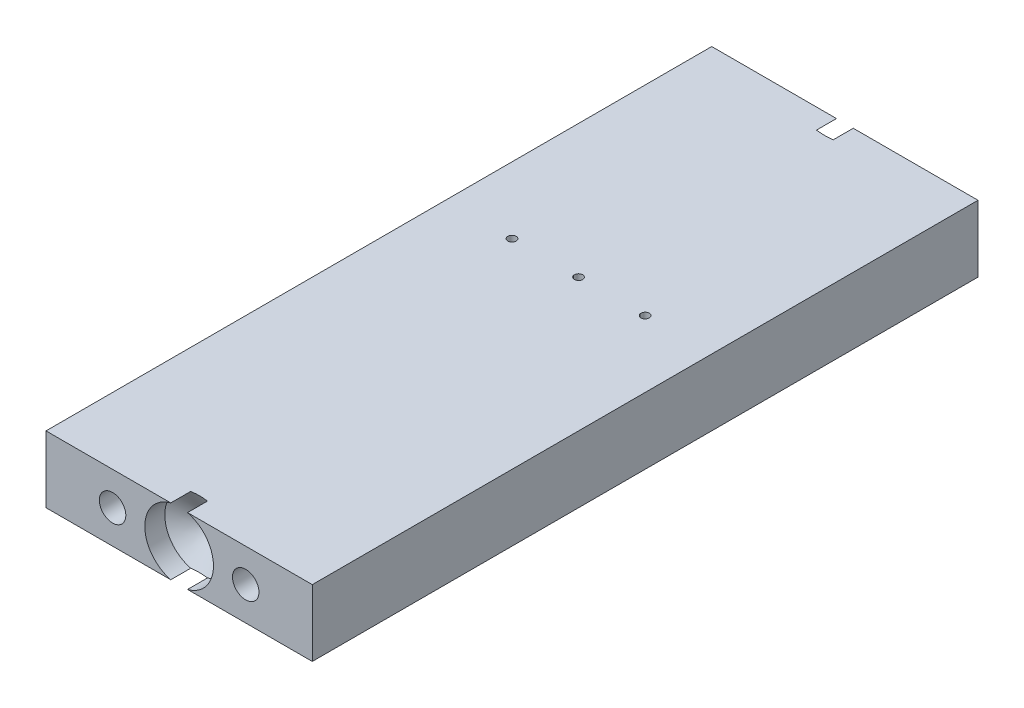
SolidWorks part; units mm, degrees
ref_plane "Front Plane" through (0, 0, 0) normal (0, 0, 1) x (1, 0, 0)
ref_plane "Top Plane" through (0, 0, 0) normal (0, 1, 0) x (1, 0, 0)
ref_plane "Right Plane" through (0, 0, 0) normal (1, 0, 0) x (0, 0, -1)
sketch "Sketch1" plane through (0, 0, 0) normal (0, 1, 0) x (1, 0, 0)
  line L1 (-25.4, -63.5) -> (25.4, -63.5)
  line L2 (-25.4, -63.5) -> (-25.4, 63.5)
  line L3 (-25.4, 63.5) -> (25.4, 63.5)
  line L4 (25.4, -63.5) -> (25.4, 63.5)
  line L5 (-25.4, -63.5) -> (25.4, 63.5) construction
  line L6 (-25.4, 63.5) -> (25.4, -63.5) construction
  point P0 (0, 0)
extrude "Boss-Extrude1" add sketch "Sketch1" along normal blind 12.7
hole_wizard "1/16 (0.0625) Diameter Hole1" positions "Sketch2" profile "Sketch4" hole size "1/16" standard "ANSI Inch"
sketch "Sketch2" plane through (0, 12.7, 0) normal (0, 1, 0) x (1, 0, 0)
  line L0 (-25.4, -63.5) -> (25.4, -63.5) construction
  point P0 (0, 12.7)
  point P2 (12.7, 12.7)
  point P4 (-12.7, 12.7)
  dimension "D1" = 12.7
  dimension "D2" = 76.2
  dimension "D3" = 76.2
  dimension "D4" = 12.7
  dimension "D5" = 12.7
  dimension "D6" = 0
sketch "Sketch4" plane through (0, 12.7, -12.7) normal (1, 0, 0) x (0, 0, 1)
  line L0 (0, 0) -> (0, 12.7)
  line L1 (0, 12.7) -> (0.7937, 12.7)
  line L2 (0.7937, 12.7) -> (0.7937, 0)
  line L5 (0.7937, 0) -> (0, 0)
  line L11 (0, -6.35) -> (0, 107.95) construction
  dimension "Thru Hole Dia." = 1.5875
  dimension "Thru Hole Depth" = 12.7
sketch "Sketch5" plane through (0, 12.7, 0) normal (0, 1, 0) x (1, 0, 0)
  line L0 (-25.4, -12.7) -> (25.4, -12.7)
  line L1 (-25.4, 63.5) -> (-25.4, -63.5) construction
  line L2 (25.4, -63.5) -> (25.4, 63.5) construction
  line L3 (25.4, -12.7) -> (-25.4, -12.7)
  line L4 (-25.4, -63.5) -> (25.4, -63.5) construction
  dimension "D1" = 50.8
hole_wizard "#8 (0.199) Diameter Hole1" positions "Sketch8" profile "Sketch10" hole size "#8" standard "ANSI Inch"
sketch "Sketch8" plane through (0, 0, 63.5) normal (0, 0, 1) x (1, 0, 0)
  line L0 (-25.4, 12.7) -> (-25.4, 0) construction
  line L1 (-25.4, 0) -> (25.4, 0) construction
  point P0 (-12.7, 6.35)
  point P2 (12.7, 6.35)
  dimension "D1" = 25.4
  dimension "D2" = 12.7
  dimension "D3" = 6.35
sketch "Sketch10" plane through (-12.7, 6.35, 63.5) normal (1, 0, 0) x (0, -1, 0)
  line L0 (0, 0) -> (0, 11.5186)
  line L1 (0, 11.5186) -> (2.5273, 10)
  line L2 (2.5273, 10) -> (2.5273, 0)
  line L5 (2.5273, 0) -> (0, 0)
  line L10 (0, 11.5186) -> (-2.5273, 10) construction
  line L11 (0, -6.35) -> (0, 107.95) construction
  dimension "Hole Dia." = 5.0546
  dimension "Hole Depth" = 10
  dimension "Drill Angle" = 118
hole_wizard "#8 (0.199) Diameter Hole2" positions "Sketch11" profile "Sketch12" hole size "#8" standard "ANSI Inch"
sketch "Sketch11" plane through (0, 0, -63.5) normal (0, 0, -1) x (-1, 0, 0)
  line L1 (-25.4, 0) -> (25.4, 0) construction
  point P0 (-12.7, 6.35)
  point P2 (12.7, 6.35)
  point P9 (0, 0)
  dimension "D1" = 25.4
  dimension "D2" = 12.7
  dimension "D3" = 6.35
sketch "Sketch12" plane through (12.7, 6.35, -63.5) normal (1, 0, 0) x (0, 1, 0)
  line L0 (0, 0) -> (0, 11.5186)
  line L1 (0, 11.5186) -> (2.5273, 10)
  line L2 (2.5273, 10) -> (2.5273, 0)
  line L5 (2.5273, 0) -> (0, 0)
  line L10 (0, 11.5186) -> (-2.5273, 10) construction
  line L11 (0, -6.35) -> (0, 107.95) construction
  dimension "Hole Dia." = 5.0546
  dimension "Hole Depth" = 10
  dimension "Drill Angle" = 118
hole_wizard "33/64 (0.51563) Diameter Hole1" positions "Sketch13" profile "Sketch14" hole size "33/64" standard "ANSI Inch"
sketch "Sketch13" plane through (0, 0, 63.5) normal (0, 0, 1) x (1, 0, 0)
  line L0 (25.4, 12.7) -> (25.4, 0) construction
  line L1 (-25.4, 0) -> (25.4, 0) construction
  point P0 (0, 6.35)
  dimension "D1" = 25.4
  dimension "D2" = 6.35
sketch "Sketch14" plane through (0, 6.35, 63.5) normal (1, 0, 0) x (0, -1, 0)
  line L0 (0, 0) -> (0, 7.7447)
  line L1 (0, 7.7447) -> (6.5485, 3.81)
  line L2 (6.5485, 3.81) -> (6.5485, 0)
  line L5 (6.5485, 0) -> (0, 0)
  line L10 (0, 7.7447) -> (-6.5485, 3.81) construction
  line L11 (0, -6.35) -> (0, 107.95) construction
  dimension "Hole Dia." = 13.097
  dimension "Hole Depth" = 3.81
  dimension "Drill Angle" = 118
hole_wizard "33/64 (0.51563) Diameter Hole2" positions "Sketch15" profile "Sketch16" hole size "33/64" standard "ANSI Inch"
sketch "Sketch15" plane through (0, 0, -63.5) normal (0, 0, -1) x (-1, 0, 0)
  line L0 (25.4, 12.7) -> (25.4, 0) construction
  line L1 (-25.4, 0) -> (25.4, 0) construction
  point P0 (0, 6.35)
  dimension "D1" = 25.4
  dimension "D2" = 6.35
sketch "Sketch16" plane through (0, 6.35, -63.5) normal (1, 0, 0) x (0, 1, 0)
  line L0 (0, 0) -> (0, 7.7447)
  line L1 (0, 7.7447) -> (6.5485, 3.81)
  line L2 (6.5485, 3.81) -> (6.5485, 0)
  line L5 (6.5485, 0) -> (0, 0)
  line L10 (0, 7.7447) -> (-6.5485, 3.81) construction
  line L11 (0, -6.35) -> (0, 107.95) construction
  dimension "Hole Dia." = 13.097
  dimension "Hole Depth" = 3.81
  dimension "Drill Angle" = 118
